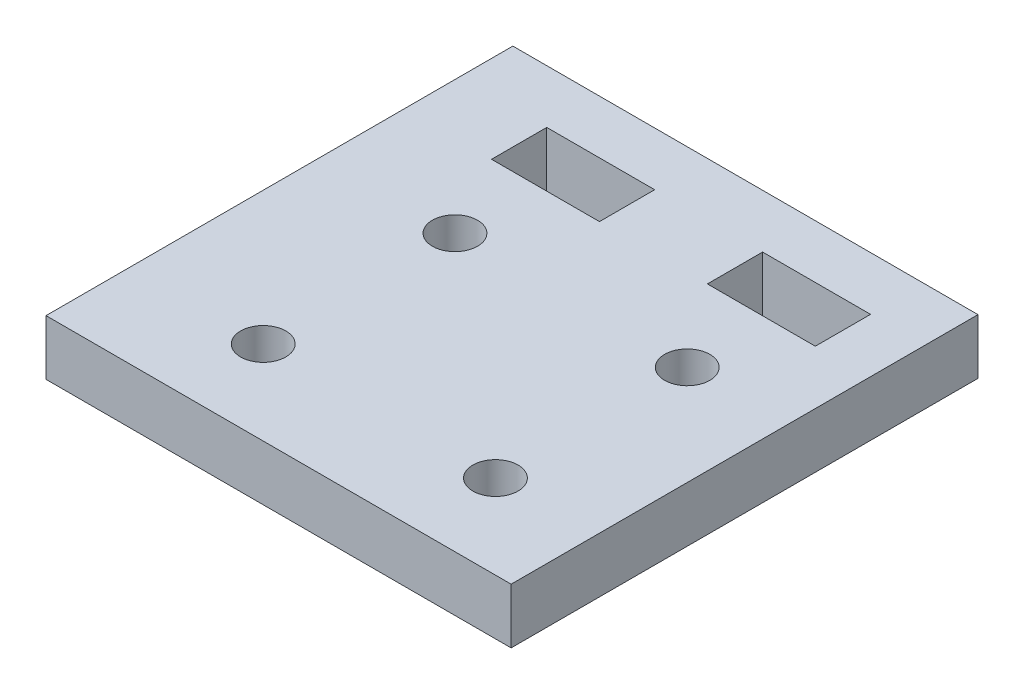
SolidWorks part; units mm, degrees
ref_plane "Front Plane" through (0, 0, 0) normal (0, 0, 1) x (1, 0, 0)
ref_plane "Top Plane" through (0, 0, 0) normal (0, 1, 0) x (1, 0, 0)
ref_plane "Right Plane" through (0, 0, 0) normal (1, 0, 0) x (0, 0, -1)
sketch "Sketch1" plane through (0, 0, 0) normal (0, 1, 0) x (1, 0, 0)
  line L0 (0, 0) -> (-43, 0) construction
  line L1 (-43, 0) -> (-43, 43) construction
  line L2 (-43, 43) -> (-26.875, 43) construction
  line L3 (0, 43) -> (0, 0) construction
  line L4 (-43, 43) -> (-43, 53.8278) construction
  line L5 (-43, 53.8278) -> (0, 53.8278) construction
  line L6 (0, 53.8278) -> (0, 43) construction
  line L7 (-43, 53.8278) -> (-46.3278, 53.8278) construction
  line L8 (-46.3278, 53.8278) -> (-46.3278, 0) construction
  line L9 (-46.3278, 0) -> (-43, 0) construction
  line L10 (-21.5, 25.1639) -> (-21.5, 43) construction
  line L11 (-46.3278, 7.3278) -> (-46.3278, 53.8278)
  line L12 (-46.3278, 53.8278) -> (0, 53.8278)
  line L13 (-26.875, 43) -> (-16.125, 43) construction
  line L14 (-26.875, 43) -> (-26.875, 48.5) construction
  line L15 (-26.875, 48.5) -> (-37.625, 48.5) construction
  line L16 (-37.625, 48.5) -> (-37.625, 43) construction
  line L17 (-16.125, 43) -> (-16.125, 48.5) construction
  line L18 (-16.125, 48.5) -> (-5.375, 48.5) construction
  line L19 (-5.375, 48.5) -> (-5.375, 43) construction
  line L20 (-46.3278, 53.8278) -> (-46.3278, 7.3278) construction
  line L21 (-46.3278, 7.3278) -> (0, 7.3278) construction
  line L22 (-43, 7.3278) -> (0, 43) construction
  line L23 (0, 7.3278) -> (-43, 43) construction
  line L24 (0, 53.8278) -> (0, 7.3278)
  line L25 (0, 7.3278) -> (-46.3278, 7.3278)
  line L26 (-37.625, 43) -> (-37.625, 48.5)
  line L27 (-37.625, 48.5) -> (-26.875, 48.5)
  line L28 (-26.875, 48.5) -> (-26.875, 43)
  line L29 (-26.875, 43) -> (-37.625, 43)
  line L30 (-16.125, 43) -> (-16.125, 48.5)
  line L31 (-16.125, 48.5) -> (-5.375, 48.5)
  line L32 (-5.375, 48.5) -> (-5.375, 43)
  line L33 (-5.375, 43) -> (-16.125, 43)
  line L34 (-16.125, 43) -> (0, 43) construction
  circle A1 centre (-33.0673, 34.7997) radius 2.25
  circle A2 centre (-9.9327, 34.7997) radius 2.25
  circle A3 centre (-9.9327, 15.7003) radius 2.25
  circle A4 centre (-33.0673, 15.7003) radius 2.25
  point P14 (-21.5, 43)
  point P20 (-16.125, 43)
extrude "Boss-Extrude1" add sketch "Sketch1" along normal blind 5.5
